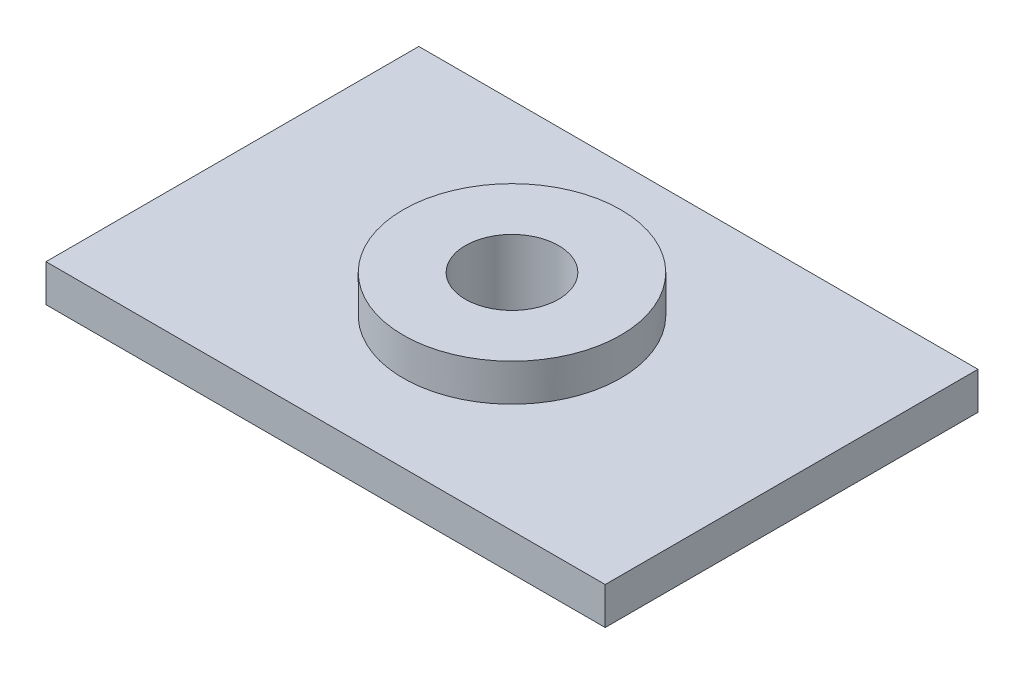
SolidWorks part; units mm, degrees
ref_plane "Front Plane" through (0, 0, 0) normal (0, 0, 1) x (1, 0, 0)
ref_plane "Top Plane" through (0, 0, 0) normal (0, 1, 0) x (1, 0, 0)
ref_plane "Right Plane" through (0, 0, 0) normal (1, 0, 0) x (0, 0, -1)
sketch "Sketch1" plane through (0, 0, 0) normal (0, 1, 0) x (1, 0, 0)
  line L1 (0, 0) -> (180, 0)
  line L2 (0, 0) -> (0, 120)
  line L3 (0, 120) -> (180, 120)
  line L4 (180, 0) -> (180, 120)
  dimension "D1" = 180
  dimension "D2" = 120
extrude "Extrude1" add sketch "Sketch1" along normal blind 12
sketch "Sketch2" plane through (0, 12, 0) normal (0, 1, 0) x (-1, 0, 0)
  line L0 (0, 0) -> (-180, 0) construction
  line L1 (0, -120) -> (0, 0) construction
  circle A0 centre (-90, -60) radius 35
  dimension "D3" = 70
  dimension "D1" = 60
  dimension "D2" = 90
extrude "Extrude2" add sketch "Sketch2" along normal blind 12
other "Hole1"
sketch "Sketch4" plane through (0, 24, 0) normal (0, 1, 0) x (-1, 0, 0)
  circle A0 centre (-90, -60) radius 15
  circle A1 centre (-90, -60) radius 35 construction
  dimension "D1" = 30
